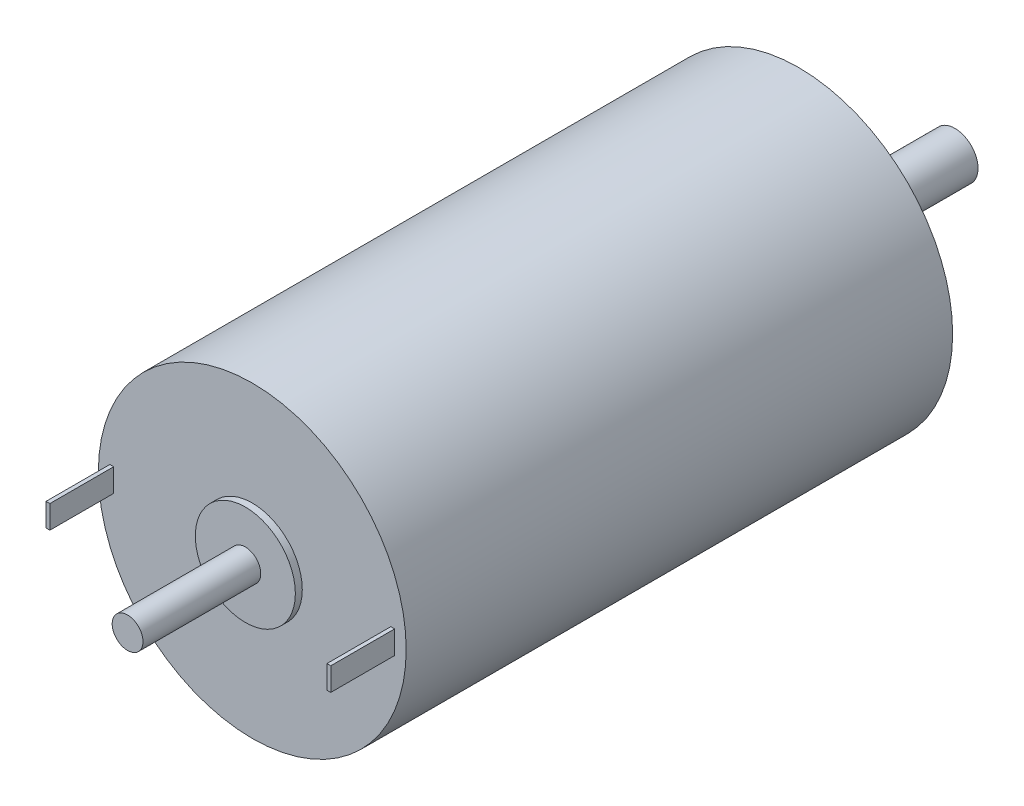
SolidWorks part; units mm, degrees
ref_plane "Front Plane" through (0, 0, 0) normal (0, 0, 1) x (1, 0, 0)
ref_plane "Top Plane" through (0, 0, 0) normal (0, 1, 0) x (1, 0, 0)
ref_plane "Right Plane" through (0, 0, 0) normal (1, 0, 0) x (0, 0, -1)
sketch "Sketch1" plane through (0, 0, 0) normal (0, 0, 1) x (1, 0, 0)
  circle A0 centre (0, 0) radius 20
  dimension "D1" = 40
extrude "body" add sketch "Sketch1" along normal blind 71
sketch "Sketch2" plane through (0, 0, 71) normal (0, 0, 1) x (1, 0, 0)
  circle A0 centre (0, 0) radius 6.5
  dimension "D1" = 13
extrude "Extrude2" add sketch "Sketch2" along normal blind 0.9
sketch "Sketch3" plane through (0, 0, 71.9) normal (0, 0, 1) x (1, 0, 0)
  circle A0 centre (0, 0) radius 2
  dimension "D1" = 4
extrude "tach_shaft" add sketch "Sketch3" along normal blind 15.3
sketch "Sketch4" plane through (0, 0, 71) normal (0, 0, 1) x (1, 0, 0)
  line L0 (0, 0) -> (0, 9.8141) construction
  line L1 (-18.5, 1.5827) -> (-18.5, -1.4173)
  line L2 (18, 1.5827) -> (18.5, 1.5827)
  line L3 (18, 1.5827) -> (18, -1.4173)
  line L4 (18, -1.4173) -> (18.5, -1.4173)
  line L5 (18.5, 1.5827) -> (18.5, -1.4173)
  line L6 (-18, -1.4173) -> (-18.5, -1.4173)
  line L7 (-18, 1.5827) -> (-18, -1.4173)
  line L8 (-18, 1.5827) -> (-18.5, 1.5827)
  dimension "D1" = 3
  dimension "D2" = 0.5
  dimension "D3" = 18
extrude "wire_tabs" add sketch "Sketch4" along normal blind 8.3
sketch "Sketch5" plane through (0, 0, 0) normal (0, 0, -1) x (-1, 0, 0)
  circle A0 centre (0, 0) radius 8
  dimension "D1" = 16
extrude "Extrude5" add sketch "Sketch5" along normal blind 1.4
sketch "Sketch6" plane through (0, 0, -1.4) normal (0, 0, -1) x (-1, 0, 0)
  circle A0 centre (0, 0) radius 4
  dimension "D1" = 8
extrude "Extrude6" add sketch "Sketch6" along normal blind 2.1
sketch "Sketch7" plane through (0, 0, 0) normal (0, 0, -1) x (-1, 0, 0)
  circle A0 centre (0, 0) radius 3
  dimension "D1" = 6
extrude "output_shaft" add sketch "Sketch7" along normal blind 20.3
sketch "Sketch8" plane through (0, 0, 0) normal (0, 0, -1) x (-1, 0, 0)
  line L0 (0, 0) -> (11, 0) construction
  circle A0 centre (11, 0) radius 1.5
  circle A1 centre (5.5, -9.5263) radius 1.5
  circle A2 centre (-5.5, -9.5263) radius 1.5
  circle A3 centre (-11, 0) radius 1.5
  circle A4 centre (-5.5, 9.5263) radius 1.5
  circle A5 centre (5.5, 9.5263) radius 1.5
  dimension "D2" = 3
  dimension "D1" = 11
extrude "output_bcd" cut sketch "Sketch8" against normal blind 5
